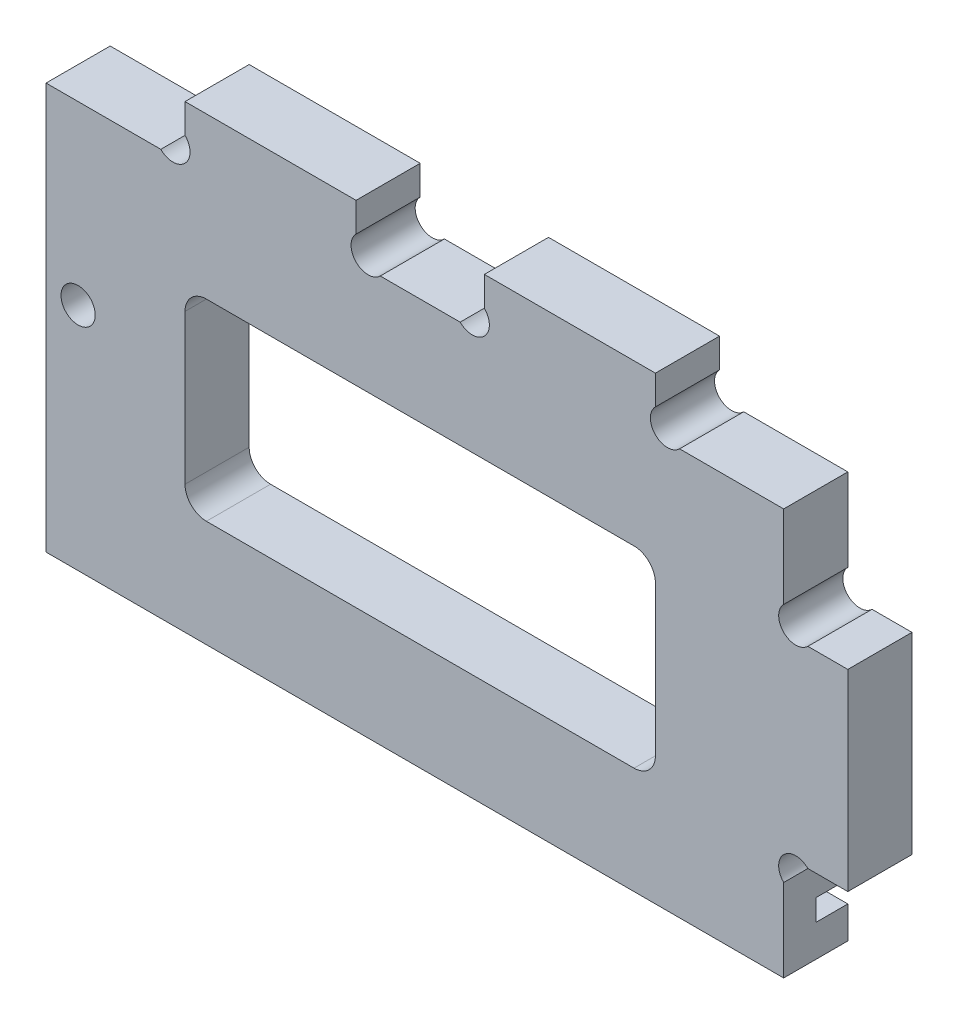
SolidWorks part; units mm, degrees
ref_plane "Plan de face" through (0, 0, 0) normal (0, 0, 1) x (1, 0, 0)
ref_plane "Plan de dessus" through (0, 0, 0) normal (0, 1, 0) x (1, 0, 0)
ref_plane "Plan de droite" through (0, 0, 0) normal (1, 0, 0) x (0, 0, -1)
sketch "Esquisse1" plane through (0, 0, 0) normal (0, 0, 1) x (1, 0, 0)
  line L0 (-27.4345, 0) -> (64.2056, 0) construction
  line L1 (-12, 47.038) -> (-12, 6.5173) construction
  line L2 (-6.6767, 43) -> (64.2056, 43) construction
  line L3 (44, 55.9741) -> (44, -5.7788) construction
  line L4 (44, 28) -> (53.9622, 37.9622) construction
  line L5 (24, 55.9741) -> (24, 15.7459) construction
  line L6 (64.2056, 38) -> (-31.4619, 38) construction
  line L7 (32, 48.6973) -> (32, 7.7373) construction
  line L8 (-14.7736, 28) -> (64.2056, 28) construction
  line L9 (-14.7736, 10) -> (64.2056, 10) construction
  line L10 (14.5822, 19) -> (64.2056, 19) construction
  line L11 (32, 38) -> (51.9587, 57.9587) construction
  line L12 (-25, -4.6271) -> (-25, 48.6973) construction
  line L13 (32, 40.2627) -> (32, 43)
  line L14 (16, 40.2627) -> (16, 43)
  line L15 (16, 43) -> (32, 43)
  line L16 (34.2627, 38) -> (44, 38)
  line L17 (44, 38) -> (44, 30.2627)
  line L18 (46.2627, 28) -> (50, 28)
  line L19 (50, 28) -> (50, 10)
  line L20 (50, 10) -> (46.2627, 10)
  line L21 (44, 7.7373) -> (44, 0)
  line L22 (44, 0) -> (-25, 0)
  line L23 (10, 33.8225) -> (10, 50.6157) construction
  line L24 (-25, 38) -> (-14.2627, 38)
  line L25 (16, 48.6973) -> (16, -5.7788) construction
  line L26 (50, 34.6858) -> (50, -12.4171) construction
  line L27 (-22, 40.7332) -> (-22, 11.5469) construction
  line L28 (-10, 28) -> (30, 28)
  line L29 (-12, 26) -> (-12, 12)
  line L30 (-10, 10) -> (30, 10)
  line L31 (4, 43) -> (-12, 43)
  line L32 (4, 40.2627) -> (4, 43)
  line L33 (-12, 40.2627) -> (-12, 43)
  line L34 (-25, 38) -> (-25, 0)
  line L35 (6.2627, 38) -> (13.7373, 38)
  line L36 (32, 26) -> (32, 12)
  line L37 (-28.5874, 21.5) -> (-20.5116, 21.5) construction
  line L38 (-30.4293, 5) -> (8.7455, 5) construction
  arc A0 (44, 30.2627) -> (46.2627, 28) centre (45.1314, 29.1314) ccw
  arc A1 (32, 40.2627) -> (34.2627, 38) centre (33.1314, 39.1314) ccw
  arc A2 (44, 7.7373) -> (46.2627, 10) centre (45.1314, 8.8686) cw
  arc A3 (16, 40.2627) -> (13.7373, 38) centre (14.8686, 39.1314) cw
  arc A4 (-10, 28) -> (-12, 26) centre (-10, 26) ccw
  arc A5 (-12, 12) -> (-10, 10) centre (-10, 12) ccw
  arc A6 (30, 10) -> (32, 12) centre (30, 12) ccw
  arc A7 (30, 28) -> (32, 26) centre (30, 26) cw
  arc A8 (-12, 40.2627) -> (-14.2627, 38) centre (-13.1314, 39.1314) cw
  arc A9 (4, 40.2627) -> (6.2627, 38) centre (5.1314, 39.1314) ccw
  circle A10 centre (-22, 21.5) radius 1.6
  dimension "D10" = 33
  dimension "D9" = 2
  dimension "D1" = 6
  dimension "D2" = 5
  dimension "D3" = 20
  dimension "D4" = 10
  dimension "D5" = 45
  dimension "D6" = 19
  dimension "D7" = 8
  dimension "D8" = 45
  dimension "D11" = 43
  dimension "D12" = 6
  dimension "D13" = 69
  dimension "D14" = 3
  dimension "D15" = 16.5
extrude "Extrusion1" add sketch "Esquisse1" along normal blind 6
sketch "Esquisse2" plane through (0, 0, 0) normal (0, 0, -1) x (-1, 0, 0)
  line L0 (32.9795, 0) -> (-46.5034, 0) construction
  line L1 (32.9795, 3) -> (-46.5034, 3) construction
  line L2 (-46.5034, 5) -> (32.9795, 5) construction
  line L4 (-44, 5) -> (25.0454, 5)
  line L5 (-44, 5) -> (-44, 3)
  line L6 (-44, 3) -> (25.0454, 3)
  line L7 (25.0454, 5) -> (25.0454, 3)
  dimension "D1" = 3
  dimension "D2" = 2
extrude "Enlèv. mat.-Extru.1" cut sketch "Esquisse2" against normal blind 3
